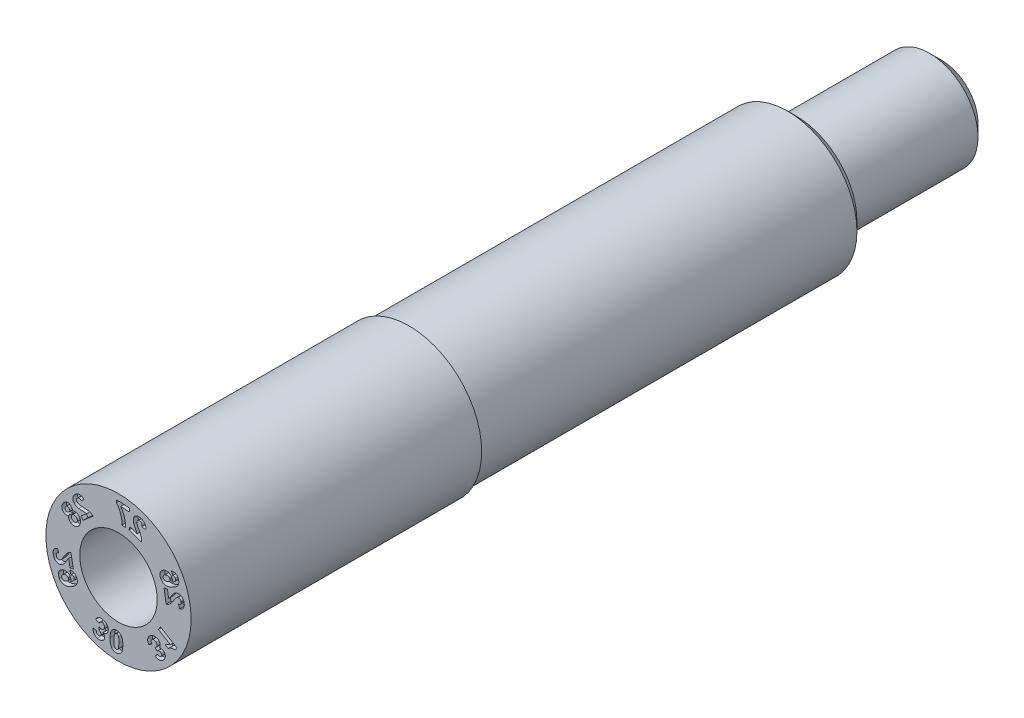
SolidWorks part; units mm, degrees
other "<M2 X .4 SHSS>-<Revolve1>"
ref_plane "Front Plane" through (0, 0, 0) normal (0, 0, 1) x (1, 0, 0)
ref_plane "Top Plane" through (0, 0, 0) normal (0, 1, 0) x (1, 0, 0)
ref_plane "Right Plane" through (0, 0, 0) normal (1, 0, 0) x (0, 0, -1)
sketch "Sketch1" plane through (0, 0, 0) normal (1, 0, 0) x (0, 0, -1)
  line L2 (0, 1.5) -> (0, 0.8)
  line L3 (13.75, 1.5) -> (0, 1.5)
  line L4 (-3.7979, 0) -> (49996.2021, 0) construction
  line L8 (11, 0.6) -> (2.2, 0.6)
  line L9 (2.2, 0.8) -> (2.2, 0.6)
  line L10 (2.2, 0.8) -> (0, 0.8)
  line L12 (14, 1) -> (14, 1.25)
  line L16 (14, 1.25) -> (13.75, 1.5)
  line L17 (14, 1) -> (11, 1)
  line L18 (11, 0.6) -> (11, 1)
  dimension "D1" = 14
  dimension "D2" = 45
  dimension "D3" = 0.25
  dimension "D4" = 3
  dimension "D5" = 1.6
  dimension "D6" = 2.2
  dimension "D7" = 1.2
  dimension "D8" = 2
  dimension "D9" = 3
revolve "Revolve1" add sketch "Sketch1" angle 360 about L4
sketch "Sketch5" plane through (0, 0, 0) normal (1, 0, 0) x (0, 0, -1)
  line L0 (0, 0) -> (50000, 0) construction
  line L1 (0, 1.5) -> (0, -1.5) construction
  line L2 (6, 1.435) -> (14, 1.435)
  line L3 (6, 1.435) -> (6, 2.435)
  line L4 (6, 2.435) -> (14, 2.435)
  line L5 (14, 1.435) -> (14, 2.435)
  line L6 (14, -1.25) -> (14, 1.25) construction
  line L7 (13.75, 1.5) -> (0, 1.5) construction
  dimension "D1" = 6
  dimension "D2" = 0.065
  dimension "D3" = 1
revolve "Cut-Revolve1" cut sketch "Sketch5" angle 360 about L0
sketch "Sketch2" plane through (0, 0, 0) normal (0, 0, 1) x (1, 0, 0)
  line L0 (0, 0) -> (0, 2.3112) construction
  line L1 (0, 0) -> (2.0015, 1.1556) construction
  line L2 (0, 0) -> (2.0015, -1.1556) construction
  line L3 (0, 0) -> (0, -2.3112) construction
  line L4 (0, 0) -> (-2.0015, -1.1556) construction
  line L5 (0, 0) -> (-2.0015, 1.1556) construction
  circle A0 centre (0, 0) radius 0.9867 construction
  text T0 "26    27    28    29    30    31" font "Arial" height 0.4
  point P10 (0, 0)
  point P746 (4, 0.001)
  point P747 (0.0034, 0.0034)
  point P748 (0.0034, 0)
  dimension "D1" = 6
extrude "Cut-Extrude1" cut sketch "Sketch2" against normal blind 0.1
sketch "Sketch3" plane through (0, 0, -2.2) normal (0, 0, 1) x (1, 0, 0)
  line L0 (0, 0) -> (0, 50000) construction
  line L1 (0.3464, 0.6) -> (-0.3464, 0.6)
  line L2 (-0.3464, 0.6) -> (-0.6928, 0)
  line L3 (-0.6928, 0) -> (-0.3464, -0.6)
  line L4 (-0.3464, -0.6) -> (0.3464, -0.6)
  line L5 (0.3464, -0.6) -> (0.6928, 0)
  line L6 (0.6928, 0) -> (0.3464, 0.6)
  line L7 (0, 0) -> (50000, 0) construction
  circle A0 centre (0, 0) radius 0.6 construction
  circle A1 centre (0, 0) radius 0.6 construction
extrude "Cut-Extrude2" cut sketch "Sketch3" against normal blind 1.4
inserted part "M2 X .4 SHSS"
move or copy body "Body-Move/Copy2" placed by mates yes
